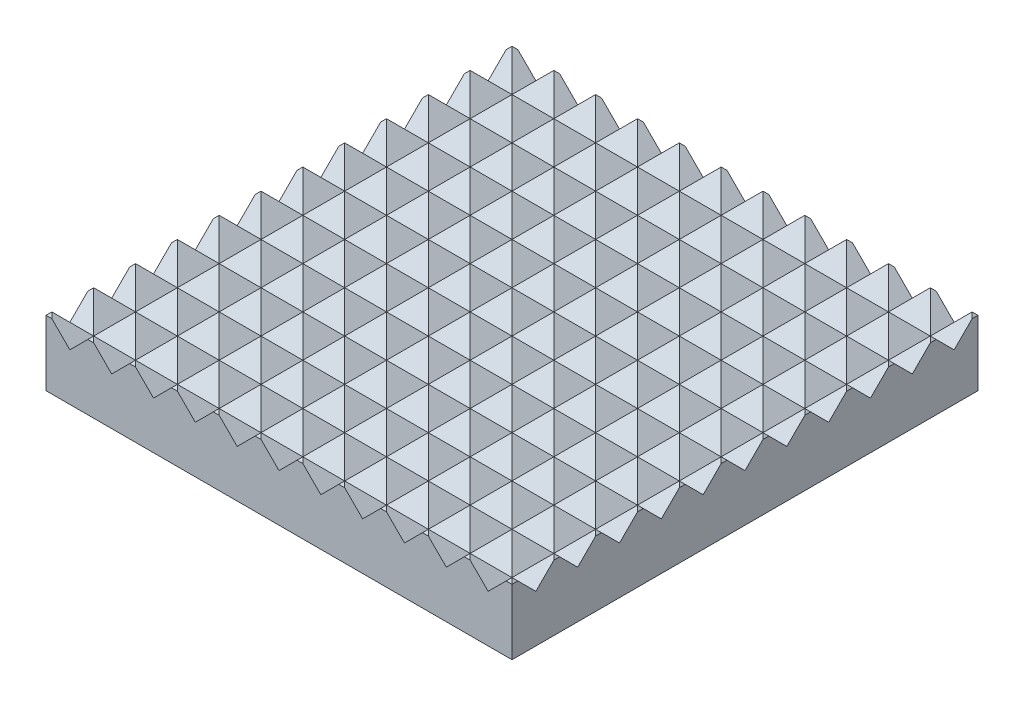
SolidWorks part; units mm, degrees
ref_plane "Front Plane" through (0, 0, 0) normal (0, 0, 1) x (1, 0, 0)
ref_plane "Top Plane" through (0, 0, 0) normal (0, 1, 0) x (1, 0, 0)
ref_plane "Right Plane" through (0, 0, 0) normal (1, 0, 0) x (0, 0, -1)
sketch "Sketch1" plane through (0, 0, 0) normal (0, 1, 0) x (1, 0, 0)
  line L0 (-12.7, -12.7) -> (-12.7, 12.7)
  line L1 (0, 0) -> (0, 50000) construction
  line L2 (0, 0) -> (50000, 0) construction
  line L3 (-12.7, 12.7) -> (12.7, 12.7)
  line L4 (12.7, -12.7) -> (12.7, 12.7)
  line L5 (-12.7, -12.7) -> (12.7, -12.7)
  point P10 (0, 12.7)
  point P11 (12.7, 0)
  point P12 (-12.7, 0)
  dimension "D1" = 25.4
  dimension "D2" = 25.4
extrude "Extrude1" add sketch "Sketch1" along normal mid plane 3.97
sketch "Sketch2" plane through (0, 0, 12.7) normal (0, 0, 1) x (1, 0, 0)
  line L0 (-13.68, 1.985) -> (-14.82, 1.985)
  line L1 (-14.82, 1.985) -> (-13.68, 0.845)
  line L2 (-12.7, -1.985) -> (12.7, -1.985) construction
  line L3 (-13.68, 0.845) -> (-12.54, 1.985)
  line L5 (-12.54, 1.985) -> (-13.68, 1.985)
  line L10 (-12.7, 1.985) -> (-12.7, -1.985) construction
  dimension "D1" = 2.28
  dimension "D2" = 2.12
  dimension "D3" = 3.97
extrude "Extrude3" cut sketch "Sketch2" against normal through all
pattern_linear "LPattern2" count 13 spacing 2.28 along (0.7071, -0.7071, 0) of "Extrude3"
sketch "Sketch3" plane through (12.7, 0, 0) normal (1, 0, 0) x (0, 0, -1)
  line L0 (-13.68, 1.985) -> (-12.54, 1.985)
  line L2 (-12.54, 1.985) -> (-13.68, 0.845)
  line L3 (-13.68, 0.845) -> (-14.82, 1.985)
  line L4 (-14.82, 1.985) -> (-13.68, 1.985)
  line L5 (-12.7, 1.825) -> (-12.7, -1.985) construction
  line L6 (9.525, -2.98) -> (-9.525, -2.98) construction
  line L8 (-12.7, -1.985) -> (12.7, -1.985) construction
  dimension "D1" = 2.28
  dimension "D2" = 2.12
  dimension "D3" = 3.97
extrude "Extrude4" cut sketch "Sketch3" against normal through all
pattern_linear "LPattern3" count 13 spacing 2.28 along (0, -0.7071, -0.7071) of "Extrude4"
chamfer "Chamfer1" distance 0.25 angle 45 4 edges at (-12.7, -1.985, 0) (0, -1.985, -12.7) (12.7, -1.985, 0) (0, -1.985, 12.7)
equation "\"D2@Sketch1\" = \"D1@Sketch1\""
equation "\"D1@Sketch3\" = \"D1@Sketch2\""
equation "\"D2@Sketch3\" = \"D2@Sketch2\""
equation "\"D3@Sketch3\" = \"D1@Extrude1\""
equation "\"D3@Sketch2\" = \"D1@Extrude1\""
